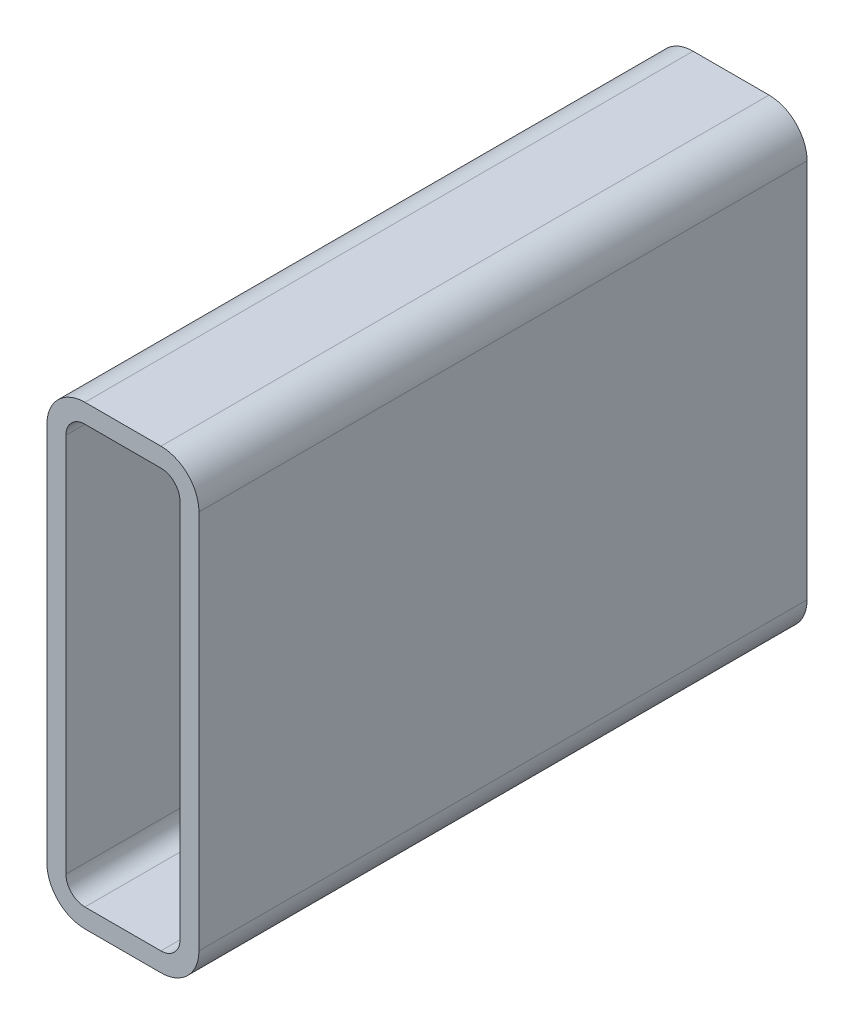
SolidWorks part; units mm, degrees
ref_plane "Front Plane" through (0, 0, 0) normal (0, 0, 1) x (1, 0, 0)
ref_plane "Top Plane" through (0, 0, 0) normal (0, 1, 0) x (1, 0, 0)
ref_plane "Right Plane" through (0, 0, 0) normal (1, 0, 0) x (0, 0, -1)
sketch "Sketch1" plane through (0, 0, 0) normal (0, 0, 1) x (1, 0, 0)
sketch_block_instance "HSS9x3x0.375-1"
sketch_block "HSS9x3x0.375"
extrude "Boss-Extrude1" add sketch "Sketch1" along normal blind 304.8
